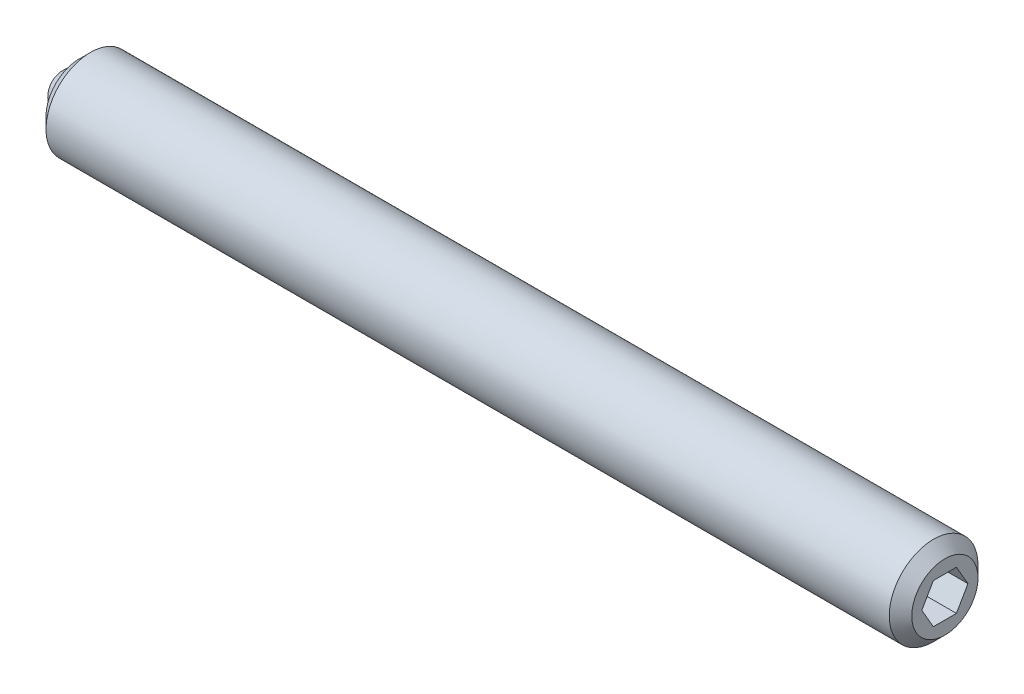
SolidWorks part; units mm, degrees
ref_plane "Front Plane" through (0, 0, 0) normal (0, 0, 1) x (1, 0, 0)
ref_plane "Top Plane" through (0, 0, 0) normal (0, 1, 0) x (1, 0, 0)
ref_plane "Right Plane" through (0, 0, 0) normal (1, 0, 0) x (0, 0, -1)
sketch "Sketch2" plane through (0, 0, 0) normal (1, 0, 0) x (0, 0, -1)
  circle A0 centre (0, 0) radius 1
  dimension "D1" = 2
extrude "Boss-Extrude1" add sketch "Sketch2" along normal blind 19.5
sketch "Sketch3" plane through (0, 0, 0) normal (-1, 0, 0) x (0, 0, 1)
  circle A0 centre (0, 0) radius 0.5
  dimension "D1" = 1
chamfer "Chamfer1" distance 0.254 angle 45 1 edges at (0, 0, -1)
chamfer "Chamfer2" distance 0.254 angle 45 1 edges at (19.5, 0, -1)
sketch "Sketch4" plane through (19.5, 0, 0) normal (1, 0, 0) x (0, 0, -1)
  line L1 (0.5196, 0) -> (0.2598, 0.45)
  line L2 (0.2598, 0.45) -> (-0.2598, 0.45)
  line L3 (-0.2598, 0.45) -> (-0.5196, 0)
  line L4 (-0.5196, 0) -> (-0.2598, -0.45)
  line L5 (-0.2598, -0.45) -> (0.2598, -0.45)
  line L6 (0.2598, -0.45) -> (0.5196, 0)
  circle A0 centre (0, 0) radius 0.45 construction
  dimension "D1" = 0.9
extrude "Cut-Extrude2" cut sketch "Sketch4" against normal blind 2
extrude "Cut-Extrude3" cut sketch "Sketch3" against normal blind 0.5
sketch "Sketch5" plane through (0, 0, 0) normal (-1, 0, 0) x (0, 0, 1)
  line L0 (0, 0) -> (0, -0.5)
  line L1 (0, 0) -> (0, 0.5)
  arc A0 (0, 0.5) -> (0, -0.5) centre (0, 0) ccw
  dimension "D1" = 0.5
revolve "Revolve1" add sketch "Sketch5" angle 360 about L1
